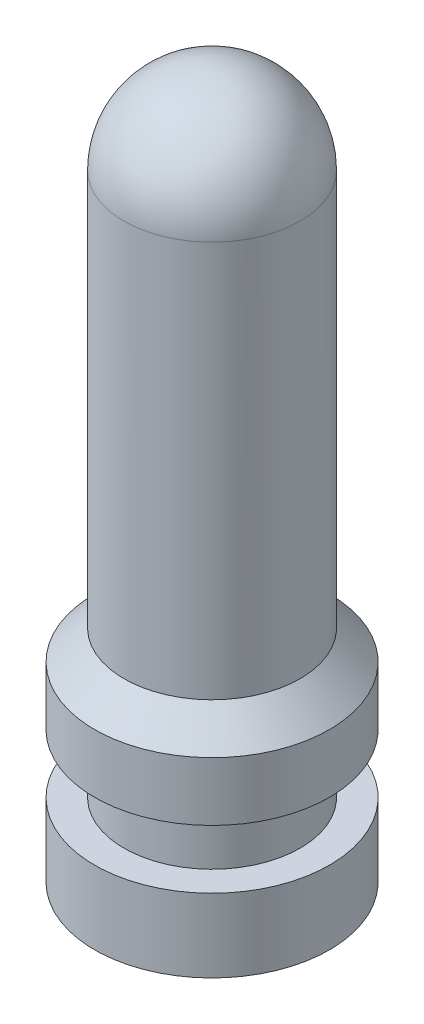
SolidWorks part; units mm, degrees
ref_plane "Plan1" through (0, 0, 0) normal (0, 0, 1) x (1, 0, 0)
ref_plane "Plan2" through (0, 0, 0) normal (0, 1, 0) x (1, 0, 0)
ref_plane "Plan3" through (0, 0, 0) normal (1, 0, 0) x (0, 0, -1)
sketch "Esquisse1" plane through (0, 0, 0) normal (0, 0, 1) x (1, 0, 0)
  line L0 (0, 0) -> (0, 80) construction
  line L1 (4, 4.5) -> (3, 4.5)
  line L2 (3.5, 0) -> (4, 0)
  line L3 (0, 3.5) -> (0, 24)
  line L4 (0, 0) -> (4, 0) construction
  line L5 (3, 21) -> (3, 7.5)
  line L6 (3, 7.5) -> (4, 7.5) construction
  line L7 (3, 7.5) -> (4, 6.5)
  line L9 (4, 6.5) -> (4, 4.5)
  line L11 (3, 2.5) -> (4, 2.5)
  line L12 (4, 2.5) -> (4, 0)
  line L13 (3, 4.5) -> (3, 2.5)
  arc A0 (0, 24) -> (3, 21) centre (0, 21) cw
  arc A1 (0, 3.5) -> (2.3635, 2.2266) centre (0, 0.67) cw
  arc A2 (2.3635, 2.2266) -> (3.5, 0) centre (0.7507, 0) cw
  dimension "D8" = 2.83
  dimension "D11" = 2.7493
  dimension "D1" = 2.5
  dimension "D2" = 24
  dimension "D3" = 7.5
  dimension "D4" = 4
  dimension "D5" = 2
  dimension "D6" = 1
  dimension "D7" = 45
  dimension "D9" = 3.5
  dimension "D10" = 3.5
revolve "Base-Révolution" add sketch "Esquisse1" angle 360 about L0
